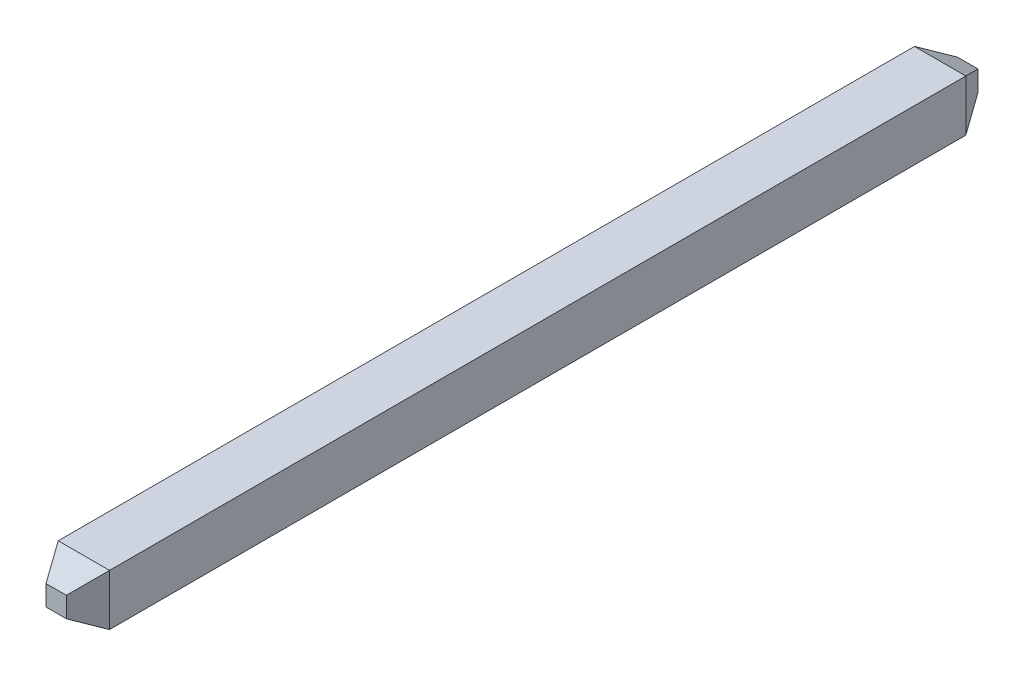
SolidWorks part; units mm, degrees
ref_plane "Front Plane" through (0, 0, 0) normal (0, 0, 1) x (1, 0, 0)
ref_plane "Top Plane" through (0, 0, 0) normal (0, 1, 0) x (1, 0, 0)
ref_plane "Right Plane" through (0, 0, 0) normal (1, 0, 0) x (0, 0, -1)
sketch "Sketch1" plane through (0, 0, 0) normal (0, 1, 0) x (1, 0, 0)
  line L5 (-0.3151, -5.6) -> (0.3151, -5.6)
  line L6 (-0.3151, -5.6) -> (-0.3151, 5.6)
  line L7 (-0.3151, 5.6) -> (0.3151, 5.6)
  line L8 (0.3151, -5.6) -> (0.3151, 5.6)
  line L9 (-0.3151, -5.6) -> (0.3151, 5.6) construction
  line L10 (-0.3151, 5.6) -> (0.3151, -5.6) construction
  point P0 (0.3151, -6.35)
  point P5 (0, 0)
  dimension "D1" = 11.2
  dimension "D2" = 0.6302
extrude "Boss-Extrude1" add sketch "Sketch1" against normal mid plane 0.63
chamfer "Chamfer1" distance 0.19 angle 60.803 8 edges at (-0.3151, 0, -5.6) (0, -0.315, -5.6) (0.3151, 0, -5.6) (0, 0.315, -5.6) (0.3151, 0, 5.6) (0, -0.315, 5.6) (-0.3151, 0, 5.6) (0, 0.315, 5.6)
